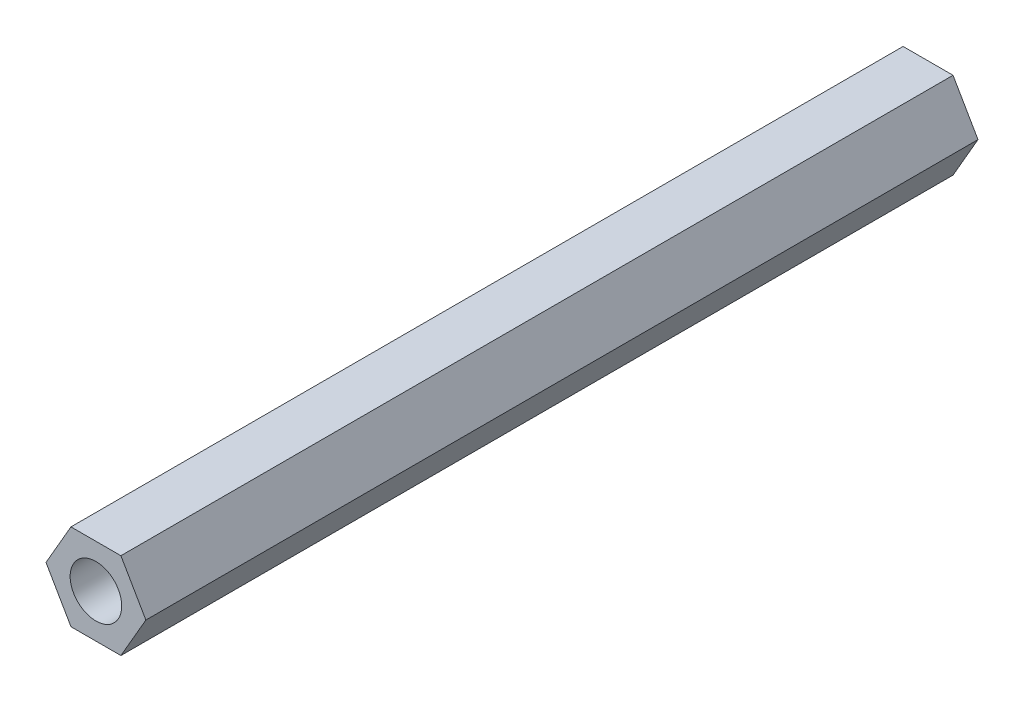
SolidWorks part; units mm, degrees
ref_plane "前视基准面" through (0, 0, 0) normal (0, 0, 1) x (1, 0, 0)
ref_plane "上视基准面" through (0, 0, 0) normal (0, 1, 0) x (1, 0, 0)
ref_plane "右视基准面" through (0, 0, 0) normal (1, 0, 0) x (0, 0, -1)
other "Configuration Table"
sketch "草图1" plane through (0, 0, 0) normal (0, 0, 1) x (1, 0, 0)
  line L7 (3, 0) -> (1.5, 2.5981)
  line L8 (1.5, 2.5981) -> (-1.5, 2.5981)
  line L9 (-1.5, 2.5981) -> (-3, 0)
  line L10 (-3, 0) -> (-1.5, -2.5981)
  line L11 (-1.5, -2.5981) -> (1.5, -2.5981)
  line L12 (1.5, -2.5981) -> (3, 0)
  circle A0 centre (0, 0) radius 2.5981 construction
  circle A1 centre (0, 0) radius 1.55
extrude "凸台-拉伸1" add sketch "草图1" along normal blind 50
